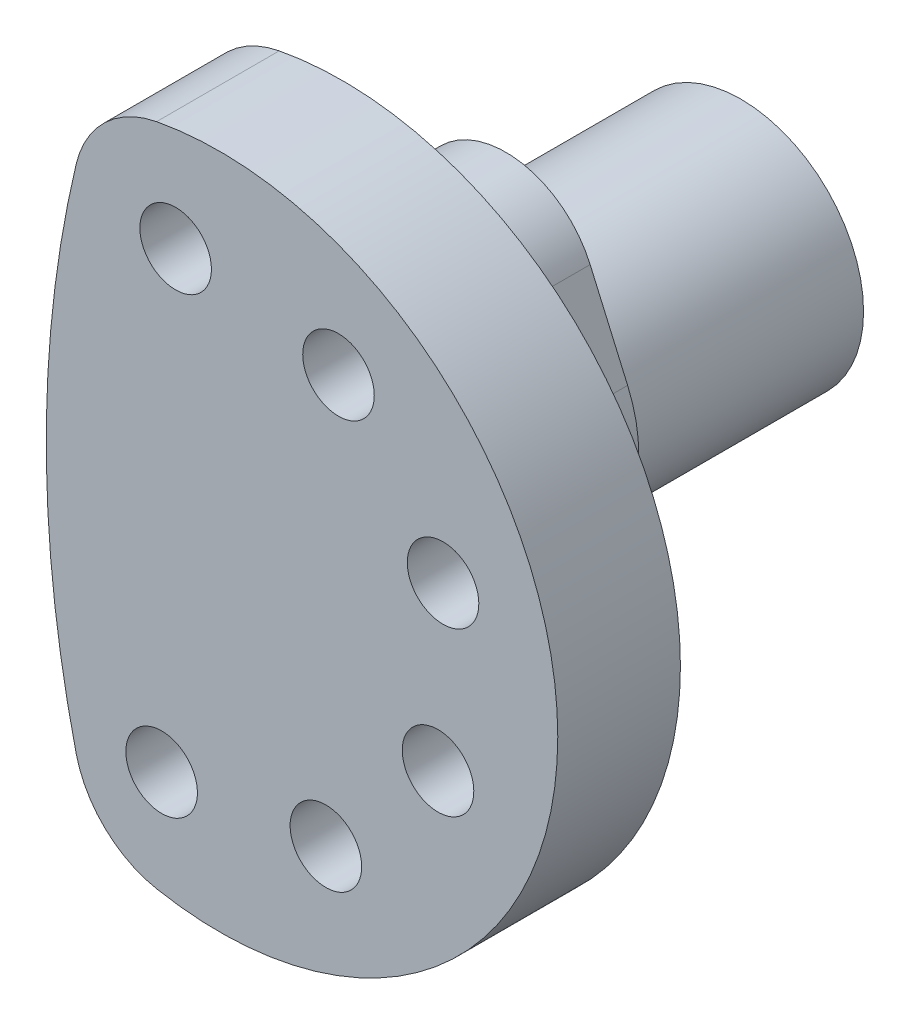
SolidWorks part; units mm, degrees
ref_plane "Front Plane" through (0, 0, 0) normal (0, 0, 1) x (1, 0, 0)
ref_plane "Top Plane" through (0, 0, 0) normal (0, 1, 0) x (1, 0, 0)
ref_plane "Right Plane" through (0, 0, 0) normal (1, 0, 0) x (0, 0, -1)
sketch "SketchTriangle" plane through (0, 0, 0) normal (0, 0, -1) x (-1, 0, 0)
  line L1 (-22, -10.3923) -> (2, -24.2487)
  line L2 (20, -13.8564) -> (20, 13.8564)
  line L3 (2, 24.2487) -> (-22, 10.3923)
  circle A0 centre (0, 0) radius 20 construction
  arc A1 (2, -24.2487) -> (20, -13.8564) centre (8, -13.8564) ccw
  arc A2 (20, 13.8564) -> (2, 24.2487) centre (8, 13.8564) ccw
  arc A3 (-22, -10.3923) -> (-22, 10.3923) centre (-16, 0) cw
  dimension "D1" = 12
  dimension "D2" = 40
sketch "Sketch2" plane through (0, 0, 0) normal (0, 0, 1) x (1, 0, 0)
  line L0 (0, 0) -> (33.0814, 0) construction
  arc A0 (-6.1748, -32.5) -> (-6.1748, 32.5) centre (0, 0) ccw
  arc A2 (-14.0369, -24.9896) -> (-6.1748, -32.5) centre (-4.3082, -22.6757) ccw
  arc A3 (-14.0369, 24.9896) -> (-6.1748, 32.5) centre (-4.3082, 22.6757) cw
  arc A4 (-14.0369, 24.9896) -> (-14.0369, -24.9896) centre (91.0322, 0) ccw
  dimension "D1" = 66.1628
  dimension "D3" = 108
  dimension "D2" = 10
  dimension "D4" = 65
extrude "Boss-Extrude1" add sketch "Sketch2" along normal blind 12 separate body
sketch "Sketch5" plane through (0, 0, 0) normal (0, 0, -1) x (-1, 0, 0)
  circle A0 centre (4.3082, 22.6757) radius 3.5
  arc A1 (14.0369, 24.9896) -> (6.1748, 32.5) centre (4.3082, 22.6757) ccw construction
  dimension "D1" = 7
extrude "Cut-Extrude1" cut sketch "Sketch5" against normal up to next contours A0
pattern_circular "CirPattern1" count 6 every 41 about axis through (0, 0, 0) along (0, 0, 1) of "Cut-Extrude1"
sketch "Sketch3" plane through (0, 0, 0) normal (0, 0, 1) x (1, 0, 0)
  line L0 (-11.9147, 5.2) -> (-8.2486, 13.6)
  line L1 (8.2486, 13.6) -> (11.9147, 5.2)
  arc A1 (-11.9147, 5.2) -> (11.9147, 5.2) centre (0, 0) ccw
  arc A2 (-8.2486, 13.6) -> (8.2486, 13.6) centre (0, 10) cw
  dimension "D1" = 9
  dimension "D3" = 13
  dimension "D2" = 10
extrude "Boss-Extrude2" add sketch "Sketch3" against normal blind 16 contours A2 L1 A1 L0
sketch "Sketch4" plane through (0, 0, -16) normal (0, 0, -1) x (-1, 0, 0)
  circle A0 centre (0, 0) radius 12
  dimension "D1" = 24
extrude "Boss-Extrude3" add sketch "Sketch4" along normal blind 23
